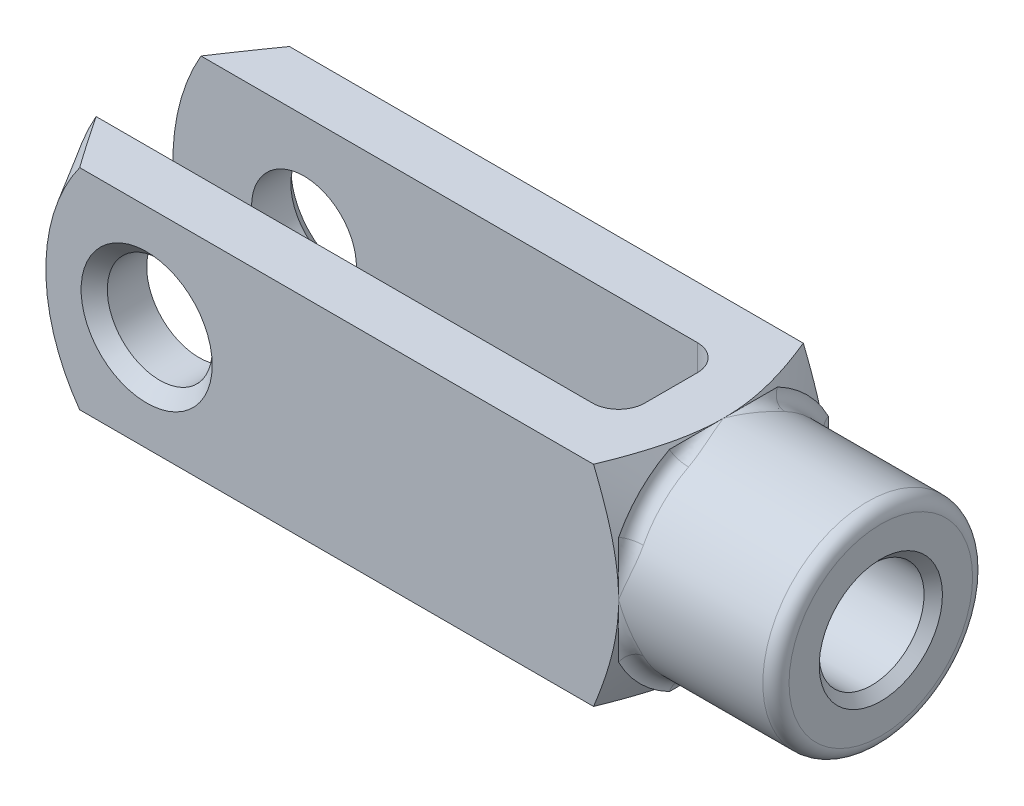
SolidWorks part; units mm, degrees
ref_plane "Front Plane" through (0, 0, 0) normal (0, 0, 1) x (1, 0, 0)
ref_plane "Top Plane" through (0, 0, 0) normal (0, 1, 0) x (1, 0, 0)
ref_plane "Right Plane" through (0, 0, 0) normal (1, 0, 0) x (0, 0, -1)
sketch "Sketch1" plane through (0, 0, 0) normal (1, 0, 0) x (0, 0, -1)
  line L0 (0, 0) -> (0, 50000) construction
  line L1 (0, 0) -> (50000, 0) construction
  line L2 (-4, -4) -> (-4, 4)
  line L3 (-4, 4) -> (4, 4)
  line L4 (4, -4) -> (4, 4)
  line L5 (-4, -4) -> (4, -4)
  point P9 (0, 4)
  point P11 (4, 0)
  point P12 (-4, 0)
  dimension "D1" = 8
  dimension "D2" = 8
extrude "Extrude1" add sketch "Sketch1" against normal blind 29
sketch "Sketch2" plane through (0, 0, 0) normal (1, 0, 0) x (0, 0, -1)
  circle A0 centre (0, 0) radius 4
  circle A1 centre (0, 0) radius 8
  dimension "D1" = 8
  dimension "D2" = 16
extrude "Extrude2" cut sketch "Sketch2" against normal blind 6
sketch "Sketch3" plane through (0, 0, 4) normal (0, 0, 1) x (1, 0, 0)
  circle A0 centre (-24, 0) radius 2
  dimension "D1" = 4
  dimension "D2" = 24
extrude "Extrude3" cut sketch "Sketch3" against normal through all
sketch "Sketch4" plane through (0, 4, 0) normal (0, 1, 0) x (1, 0, 0)
  line L0 (0, 0) -> (-50000, 0) construction
  line L1 (-29, -2) -> (-29, 2)
  line L2 (-29, 4) -> (-29, -4) construction
  line L3 (-29, 2) -> (-8, 2)
  line L4 (-8, 2) -> (-8, -2)
  line L5 (-24, 4) -> (-24, -4) construction
  line L6 (-29, -2) -> (-8, -2)
  point P7 (-24, 0)
  point P13 (-8, 0)
  point P14 (-29, 0)
  dimension "D1" = 16
  dimension "D2" = 4
extrude "Extrude4" cut sketch "Sketch4" against normal through all
fillet "Fillet1" radius 1 2 edges at (-8, 0, 2) (-8, 0, -2)
fillet "Fillet2" radius 0.5 5 edges at (0, 0, -4) (-6, 2.8284, 2.8284) (-6, 2.8284, -2.8284) (-6, -2.8284, -2.8284) (-6, -2.8284, 2.8284)
chamfer "Chamfer2" distance 0.5 angle 45 2 edges at (-22, 0, -4) (-22, 0, 4)
sketch "Sketch6" plane through (0, 0, 0) normal (0, 0, 1) x (1, 0, 0)
  line L0 (-6, -4) -> (-6, -8)
  line L1 (-6, -8) -> (-8.3094, -8)
  line L2 (-8.3094, -8) -> (-6, -4)
  dimension "D1" = 30
  dimension "D2" = 8
revolve "Cut-Revolve1" cut sketch "Sketch6" angle 360 about axis through (-6, 0, 0) along (1, 0, 0)
sketch "Sketch7" plane through (0, 0, 0) normal (0, 1, 0) x (1, 0, 0)
  line L0 (-27.8453, -4) -> (-29, -2)
  line L1 (-29, 2) -> (-27.8453, 4)
  line L2 (-27.8453, 4) -> (-37, 4)
  line L3 (-29, 2) -> (-29, -2)
  line L4 (-37, 4) -> (-37, -4)
  line L5 (-37, -4) -> (-27.8453, -4)
  line L6 (-29, 4) -> (-6.9566, 4) construction
  line L7 (-29, -4) -> (-6.9566, -4) construction
  line L8 (-21, 0.6162) -> (-21, 50000.6162) construction
  dimension "D1" = 120
  dimension "D2" = 8
  dimension "D3" = 8
revolve "Cut-Revolve2" cut sketch "Sketch7" angle 180 about L8
sketch "Sketch8" plane through (0, 0, 0) normal (1, 0, 0) x (0, 0, -1)
  circle A0 centre (0, 0) radius 2
  dimension "D1" = 4
extrude "Extrude5" cut sketch "Sketch8" against normal through all
chamfer "Chamfer3" distance 0.35 angle 45 1 edges at (0, 0, -2)
equation "\"D2@Sketch1\" = \"D1@Sketch1\""
equation "\"D2@Sketch2\" = \"D1@Sketch2\"*2"
equation "\"D2@Sketch6\" = \"D1@Sketch1\""
equation "\"D2@Sketch7\" = \"D1@Sketch1\""
equation "\"D3@Sketch7\" = \"D1@Sketch1\""
